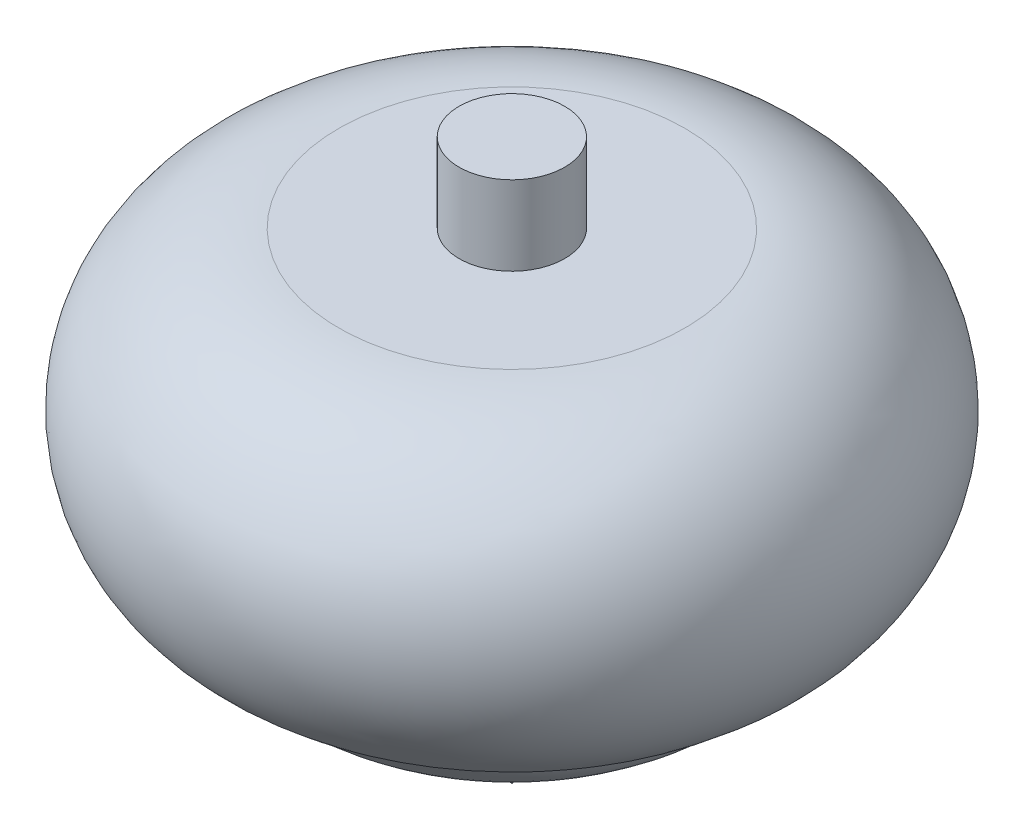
SolidWorks part; units mm, degrees
ref_plane "Plane1" through (0, 0, 0) normal (0, 0, 1) x (1, 0, 0)
ref_plane "Plane2" through (0, 0, 0) normal (0, 1, 0) x (1, 0, 0)
ref_plane "Plane3" through (0, 0, 0) normal (1, 0, 0) x (0, 0, -1)
sketch "Sketch1" plane through (0, 0, 0) normal (0, 0, 1) x (1, 0, 0)
  line L0 (7.5607, 68.8864) -> (24.7823, 68.8864)
  line L1 (0, 0) -> (14.2813, 17.6416)
  line L2 (0, 0) -> (0, 95.7689) construction
  line L3 (0, 80.2274) -> (7.5607, 80.2274)
  line L4 (7.5607, 80.2274) -> (7.5607, 68.8864)
  line L5 (0, 0) -> (0, 80.2274)
  arc A0 (24.7823, 68.8864) -> (33.1831, 25.6224) centre (24.7823, 46.4388) cw
  arc A1 (14.2813, 17.6416) -> (33.1831, 25.6224) centre (18.581, 33.8322) ccw
revolve "Base-Revolve" add sketch "Sketch1" angle 360 about L2
